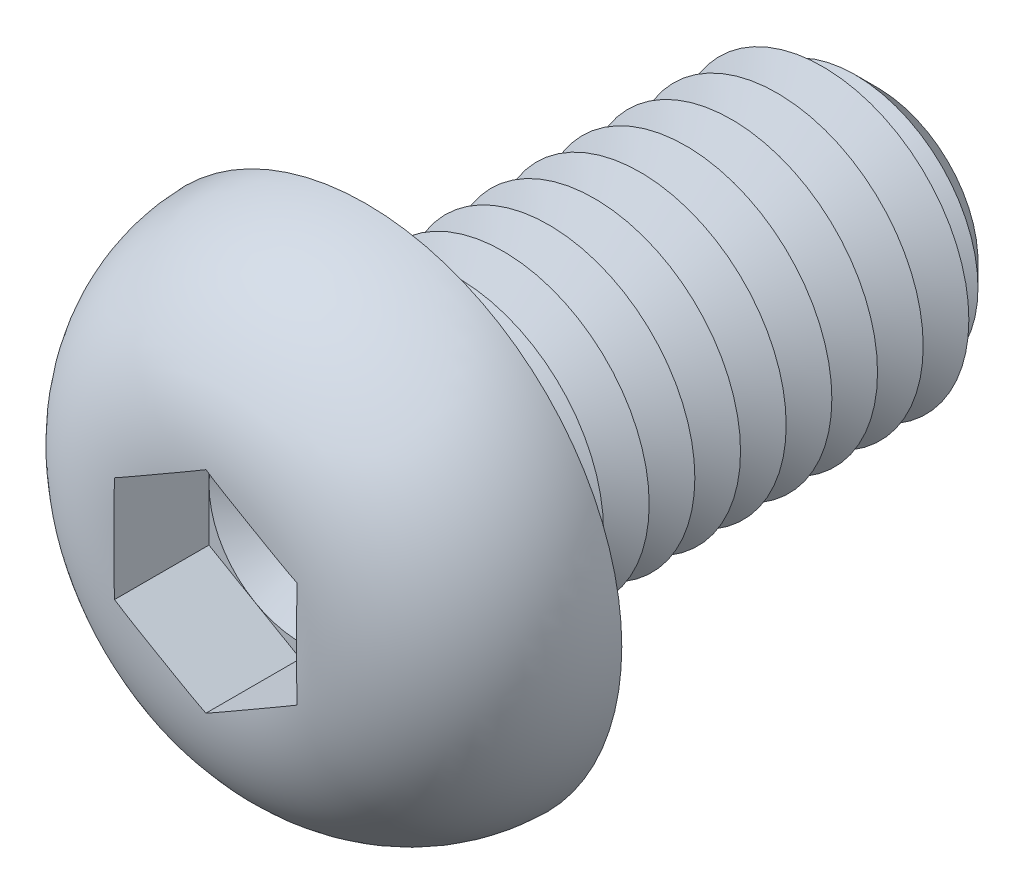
SolidWorks part; units mm, degrees
ref_plane "Front Plane" through (0, 0, 0) normal (0, 0, 1) x (1, 0, 0)
ref_plane "Top Plane" through (0, 0, 0) normal (0, 1, 0) x (1, 0, 0)
ref_plane "Right Plane" through (0, 0, 0) normal (1, 0, 0) x (0, 0, -1)
sketch "Sketch1" plane through (0, 0, 0) normal (1, 0, 0) x (0, 0, -1)
  line L0 (-47.9342, 0) -> (60.3146, 0) construction
sketch "Sketch2" plane through (0, 0, 0) normal (1, 0, 0) x (0, 0, -1)
  line L0 (0, 0) -> (-4.4, 0)
  line L1 (-47.9342, 0) -> (60.3146, 0) construction
  line L2 (-4.4, 0) -> (-4.4, 2.5011)
  line L3 (0, 7) -> (0, 0)
  arc A0 (-4.4, 2.5011) -> (0, 7) centre (0.1, 2.5011) cw
  dimension "D1" = 4.5
  dimension "D2" = 4.4
  dimension "D3" = 7
revolve "Revolve1" add sketch "Sketch2" angle 360 about L0
sketch "Sketch3" plane through (0, 0, 4.4) normal (0, 0, 1) x (1, 0, 0)
  line L1 (0, 2.8868) -> (-2.5, 1.4434)
  line L2 (-2.5, 1.4434) -> (-2.5, -1.4434)
  line L3 (-2.5, -1.4434) -> (0, -2.8868)
  line L4 (0, -2.8868) -> (2.5, -1.4434)
  line L5 (2.5, -1.4434) -> (2.5, 1.4434)
  line L6 (2.5, 1.4434) -> (0, 2.8868)
  circle A0 centre (0, 0) radius 2.5 construction
  dimension "D1" = 5
extrude "Cut-Extrude1" cut sketch "Sketch3" against normal blind 2.6
sketch "Sketch4" plane through (0, 0, 0) normal (0, 0, -1) x (-1, 0, 0)
  circle A0 centre (0, 0) radius 4
  dimension "D1" = 8
extrude "Boss-Extrude1" add sketch "Sketch4" along normal blind 14
chamfer "Chamfer1" distance 1.25 angle 45 1 edges at (-4, 0, -14)
sketch "Sketch5" plane through (0, 0, 0) normal (1, 0, 0) x (0, 0, -1)
  line L0 (1.25, 4) -> (2.5, 4)
  line L1 (12.75, 4) -> (0, 4) construction
  line L2 (2.5, 4) -> (1.875, 2.9175)
  line L3 (1.875, 2.9175) -> (1.25, 4)
  line L4 (0, -7) -> (0, 7) construction
  line L5 (12.75, 4) -> (0, 4) construction
  dimension "D1" = 1.25
  dimension "D2" = 1.25
revolve "Cut-Revolve1" cut sketch "Sketch5" angle 360 about L0
pattern_linear "LPattern1" count 10 spacing 1.25 along (0, 0, -1) of "Cut-Revolve1"
fillet "Fillet2" radius 0.5 1 edges at (4, 0, 0)
sketch "Sketch6" plane through (0, 0, 1.8) normal (0, 0, 1) x (1, 0, 0)
  line L0 (0, -2.8868) -> (2.5, -1.4434) construction
  circle A0 centre (0, 0) radius 2.5
extrude "Cut-Extrude2" cut sketch "Sketch6" against normal through all draft 60
